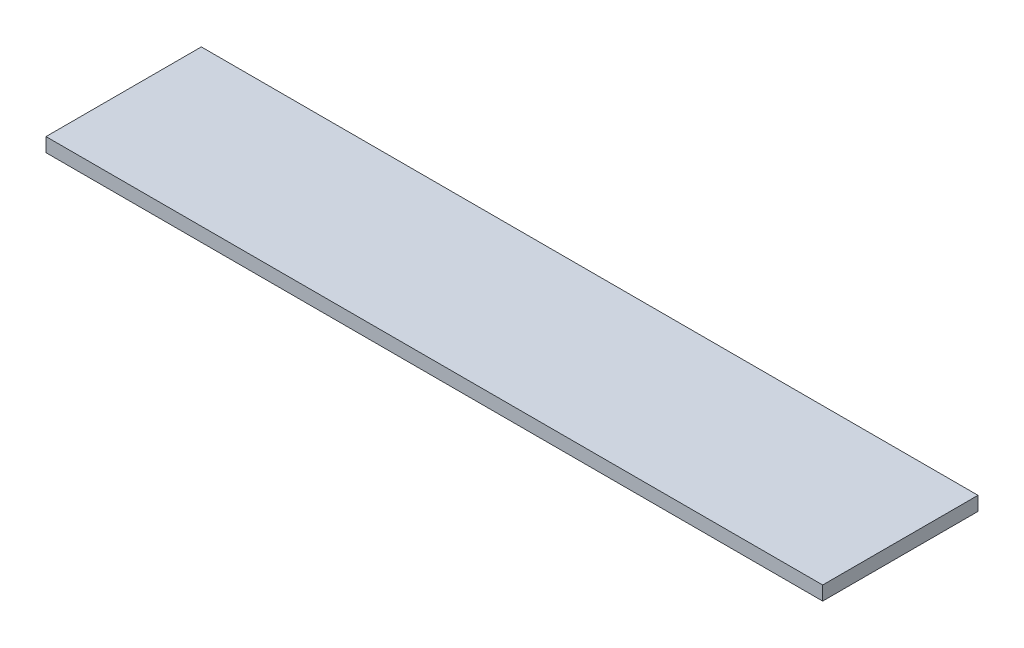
SolidWorks part; units mm, degrees
ref_plane "Plan de face" through (0, 0, 0) normal (0, 0, 1) x (1, 0, 0)
ref_plane "Plan de dessus" through (0, 0, 0) normal (0, 1, 0) x (1, 0, 0)
ref_plane "Plan de droite" through (0, 0, 0) normal (1, 0, 0) x (0, 0, -1)
sketch "Esquisse1" plane through (0, 0, 0) normal (0, 0, 1) x (1, 0, 0)
  line L1 (2500, -45) -> (-2500, -45)
  line L2 (2500, -45) -> (2500, 45)
  line L3 (2500, 45) -> (-2500, 45)
  line L4 (-2500, -45) -> (-2500, 45)
  line L5 (2500, -45) -> (-2500, 45) construction
  line L6 (2500, 45) -> (-2500, -45) construction
  point P0 (0, 0)
  dimension "D1" = 5000
  dimension "D2" = 90
extrude "Boss.-Extru.1" add sketch "Esquisse1" along normal mid plane 1000
